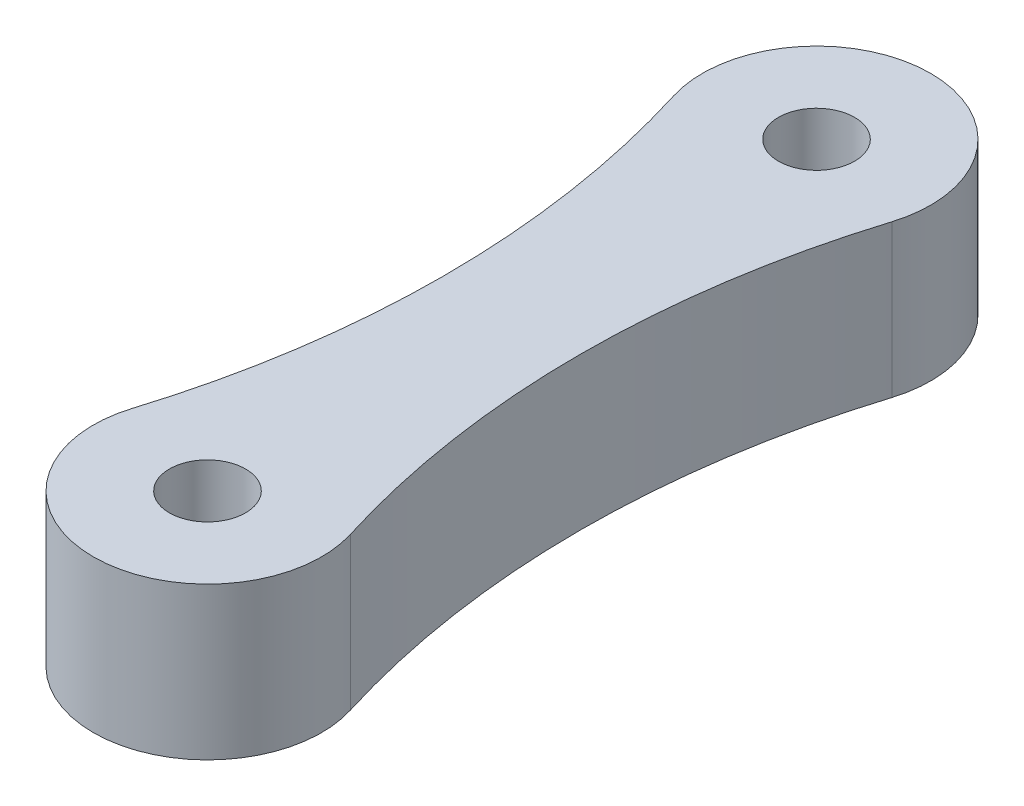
SolidWorks part; units mm, degrees
ref_plane "Front Plane" through (0, 0, 0) normal (0, 0, 1) x (1, 0, 0)
ref_plane "Top Plane" through (0, 0, 0) normal (0, 1, 0) x (1, 0, 0)
ref_plane "Right Plane" through (0, 0, 0) normal (1, 0, 0) x (0, 0, -1)
sketch "Sketch1" plane through (0, 0, 0) normal (0, 1, 0) x (1, 0, 0)
  arc A0 (-7.5, 0) -> (7.5, 0) centre (0, 0) ccw
  arc A1 (7.5, 40) -> (-7.5, 40) centre (0, 40) ccw
  circle A2 centre (0, 40) radius 2.5
  circle A3 centre (0, 0) radius 2.5
  circle A4 centre (0, 40) radius 7.5 construction
  circle A5 centre (0, 0) radius 7.5 construction
  arc A6 (-7.1632, 37.7778) -> (-7.1632, 2.2222) centre (-64.469, 20) cw
  arc A7 (7.1632, 37.7778) -> (7.1632, 2.2222) centre (64.469, 20) ccw
  arc A8 (-7.1632, 37.7778) -> (-7.5, 40) centre (0, 40) cw
  arc A9 (7.5, 40) -> (7.1632, 37.7778) centre (0, 40) cw
  arc A10 (-7.5, 0) -> (-7.1632, 2.2222) centre (0, 0) cw
  arc A11 (7.5, 0) -> (7.1632, 2.2222) centre (0, 0) ccw
  dimension "D1" = 15
  dimension "D3" = 5
  dimension "D4" = 60
  dimension "D2" = 40
extrude "Boss-Extrude1" add sketch "Sketch1" along normal mid plane 10
